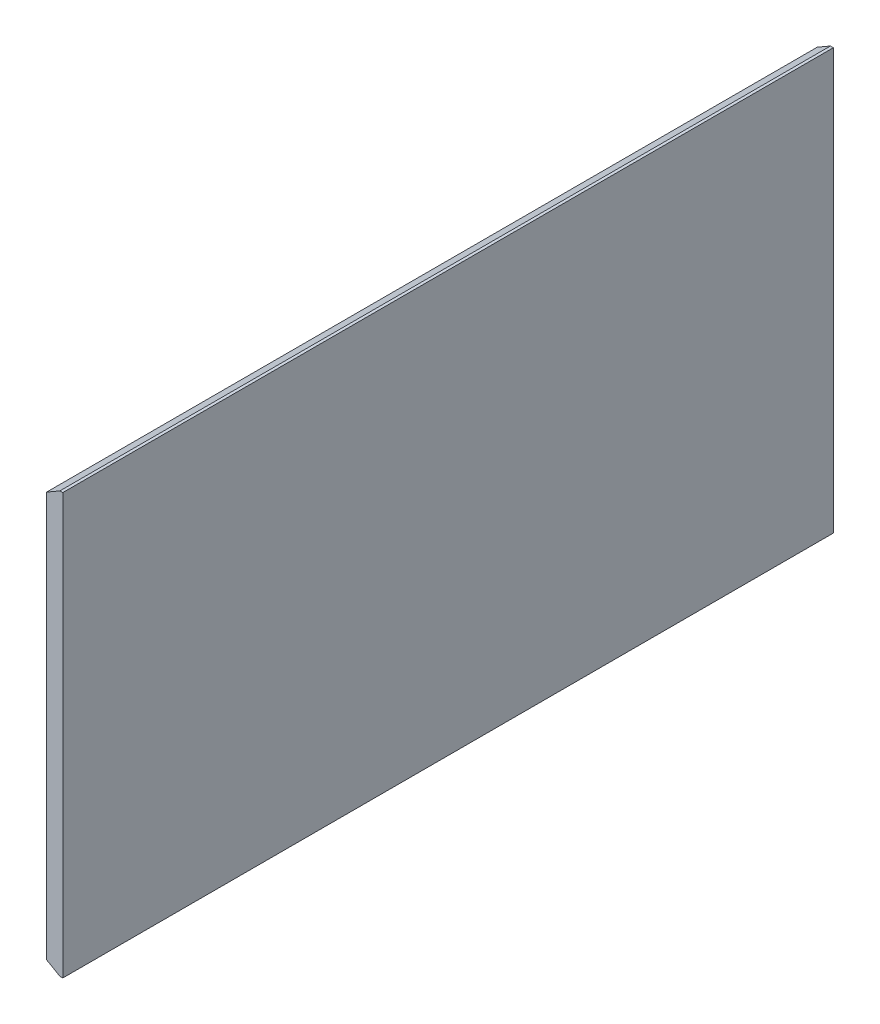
SolidWorks part; units mm, degrees
ref_plane "Front Plane" through (0, 0, 0) normal (1, 0, 0) x (0, 1, 0)
ref_plane "Top Plane" through (0, 0, 0) normal (0, 0, 1) x (0, 1, 0)
ref_plane "Right Plane" through (0, 0, 0) normal (0, 1, 0) x (-1, 0, 0)
sketch "Sketch1" plane through (0, 0, 0) normal (1, 0, 0) x (0, 1, 0)
  line L1 (-579, 1061.35) -> (579, 1061.35)
  line L2 (-579, 1061.35) -> (-579, -1061.35)
  line L3 (-579, -1061.35) -> (579, -1061.35)
  line L4 (579, 1061.35) -> (579, -1061.35)
  line L5 (-579, 1061.35) -> (579, -1061.35) construction
  line L6 (-579, -1061.35) -> (579, 1061.35) construction
  point P0 (0, 0)
  dimension "D1" = 2122.7
  dimension "D2" = 1158
extrude "Boss-Extrude1" add sketch "Sketch1" along normal mid plane 44.45
chamfer "Chamfer1" distance 21 angle 60 2 edges at (-22.225, 579, 0) (-22.225, -579, 0)
